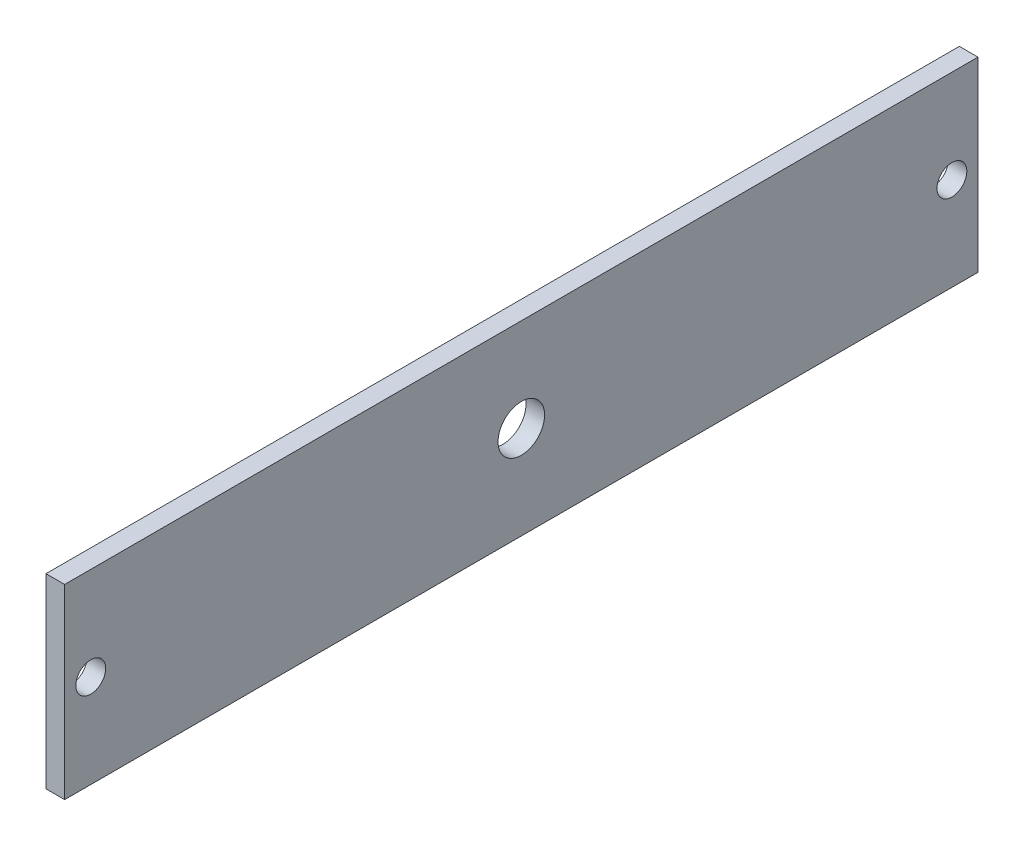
SolidWorks part; units mm, degrees
ref_plane "Front" through (0, 0, 0) normal (0, 0, 1) x (1, 0, 0)
ref_plane "Top" through (0, 0, 0) normal (0, 1, 0) x (1, 0, 0)
ref_plane "Right" through (0, 0, 0) normal (1, 0, 0) x (0, 0, -1)
sketch "Sketch1" plane through (0, 0, 0) normal (1, 0, 0) x (0, 0, -1)
  line L1 (-124.46, 25.4) -> (0, 25.4)
  line L2 (-124.46, 25.4) -> (-124.46, 0)
  line L3 (-124.46, 0) -> (0, 0)
  line L4 (0, 25.4) -> (0, 0)
  dimension "D1" = 124.46
  dimension "D2" = 25.4
extrude "Boss-Extrude1" add sketch "Sketch1" along normal blind 2.54
sketch "Sketch2" plane through (2.54, 0, 0) normal (1, 0, 0) x (0, 0, -1)
  line L0 (-124.46, 25.4) -> (-124.46, 0) construction
  line L1 (-62.23, 33.4433) -> (-62.23, -26.9279) construction
  line L2 (0, 25.4) -> (-124.46, 25.4) construction
  circle A0 centre (-120.904, 12.7) radius 2.032
  circle A1 centre (-3.556, 12.7) radius 2.032
  point P2 (-124.46, 12.7)
  point P9 (-62.23, 25.4)
  dimension "D1" = 4.064
extrude "Cut-Extrude1" cut sketch "Sketch2" against normal blind 2.54
sketch "Sketch5" plane through (2.54, 0, 0) normal (1, 0, 0) x (0, 0, -1)
  line L0 (0, 25.4) -> (-124.46, 25.4) construction
  line L1 (0, 0) -> (0, 25.4) construction
  circle A0 centre (-62.23, 12.7) radius 3.175
  point P2 (-62.23, 25.4)
  point P3 (0, 12.7)
  point P6 (0, 0)
  dimension "D1" = 6.35
extrude "Cut-Extrude2" cut sketch "Sketch5" against normal blind 2.54
sketch "Sketch6" plane through (0, 0, 0) normal (-1, 0, 0) x (0, 0, 1)
  line L0 (0, 12.7) -> (124.46, 12.7) construction
  line L1 (0, 0) -> (0, 25.4) construction
  line L2 (124.46, 25.4) -> (124.46, 0) construction
